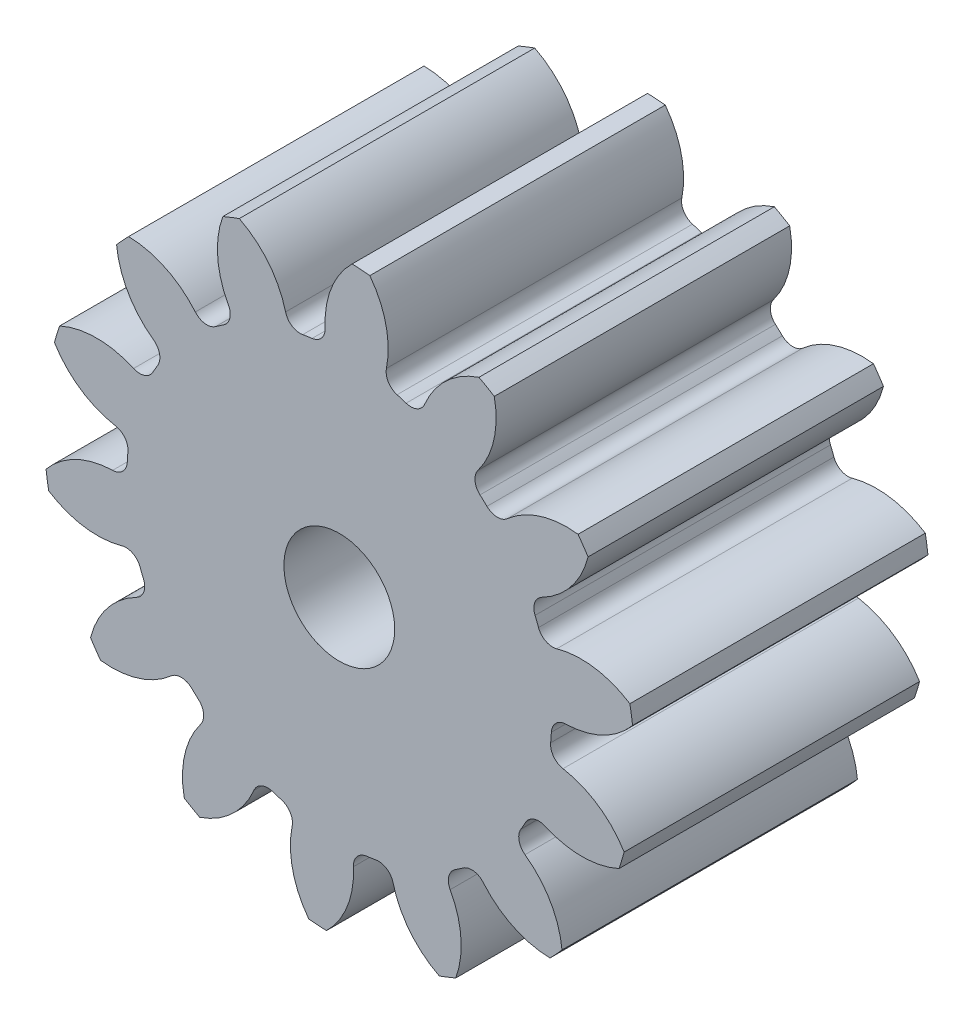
SolidWorks part; units mm, degrees
ref_plane "Front" through (0, 0, 0) normal (0, 0, 1) x (1, 0, 0)
ref_plane "Top" through (0, 0, 0) normal (0, 1, 0) x (1, 0, 0)
ref_plane "Right" through (0, 0, 0) normal (1, 0, 0) x (0, 0, -1)
sketch "Sketch3" plane through (0, 0, 0) normal (0, 0, 1) x (1, 0, 0)
  circle A0 centre (0, 0) radius 101.6
  dimension "od" = 203.2
extrude "gearBody" add sketch "Sketch3" along normal blind 101.6
sketch "Sketch2" plane through (0, 0, 0) normal (0, 0, 1) x (1, 0, 0)
  line L0 (0, 0) -> (77.1797, 31.9689) construction
  line L1 (98.572, -27.9231) -> (0, 0) construction
  line L2 (0, 0) -> (36.3143, 0) construction
  line L3 (88.8333, 3.4426) -> (87.3696, -16.4246) construction
  line L5 (88.1014, -6.491) -> (0, 0) construction
  line L7 (0, 0) -> (83.5387, 0) construction
  arc A0 (83.519, 1.8131) -> (82.3514, -14.0339) centre (0, 0) ccw construction
  arc A1 (100.8589, 12.2495) -> (97.9745, -26.8989) centre (0, 0) ccw construction
  arc A2 (88.8333, 3.4426) -> (87.3696, -16.4246) centre (0, 0) ccw construction
  arc A3 (72.6897, -6.99) -> (72.9292, -3.7387) centre (0, 0) ccw
  arc A4 (98.572, -27.9231) -> (76.948, -12.577) centre (71.661, -42.9349) ccw
  arc A5 (98.572, -27.9231) -> (101.6, 13.1752) centre (0, 0) ccw
  arc A6 (101.6, 13.1752) -> (77.9604, 1.1639) centre (77.1797, 31.9689) cw
  arc A7 (72.9292, -3.7387) -> (77.9604, 1.1639) centre (78.0914, -4.0033) cw
  arc A8 (76.948, -12.577) -> (72.6897, -6.99) centre (77.8349, -7.4847) cw
  point P6 (101.6, 13.1752)
  point P22 (98.572, -27.9231)
  dimension "baseDia" = 167.0773
  dimension "od" = 203.2
  dimension "pd" = 177.8
  dimension "rd" = 146.05
  dimension "rFillet" = 5.1689
  dimension "pointX" = 101.6
  dimension "pointY" = 13.1752
  dimension "CTT" = 19.8672
  dimension "flankCenterAngle" = 22.5
extrude "toothCut" cut sketch "Sketch2" along normal through all
pattern_circular "CirPattern1" count 14 over 360 about axis through (0, 0, 0) along (0, 0, 1) of "toothCut"
sketch "hub1Dia" plane through (0, 0, 0) normal (0, 0, -1) x (-1, 0, 0)
  circle A0 centre (0, 0) radius 12.7
  dimension "hub1Dia" = 25.4
sketch "hub2Dia" plane through (0, 0, 101.6) normal (0, 0, 1) x (1, 0, 0)
  circle A0 centre (0, 0) radius 12.7
  dimension "hub2dia" = 25.4
sketch "boreDia" plane through (0, 0, 0) normal (0, 0, 1) x (1, 0, 0)
  circle A0 centre (0, 0) radius 19.05
  dimension "boreDia" = 38.1
extrude "bore" cut sketch "boreDia" against normal mid plane 25400
